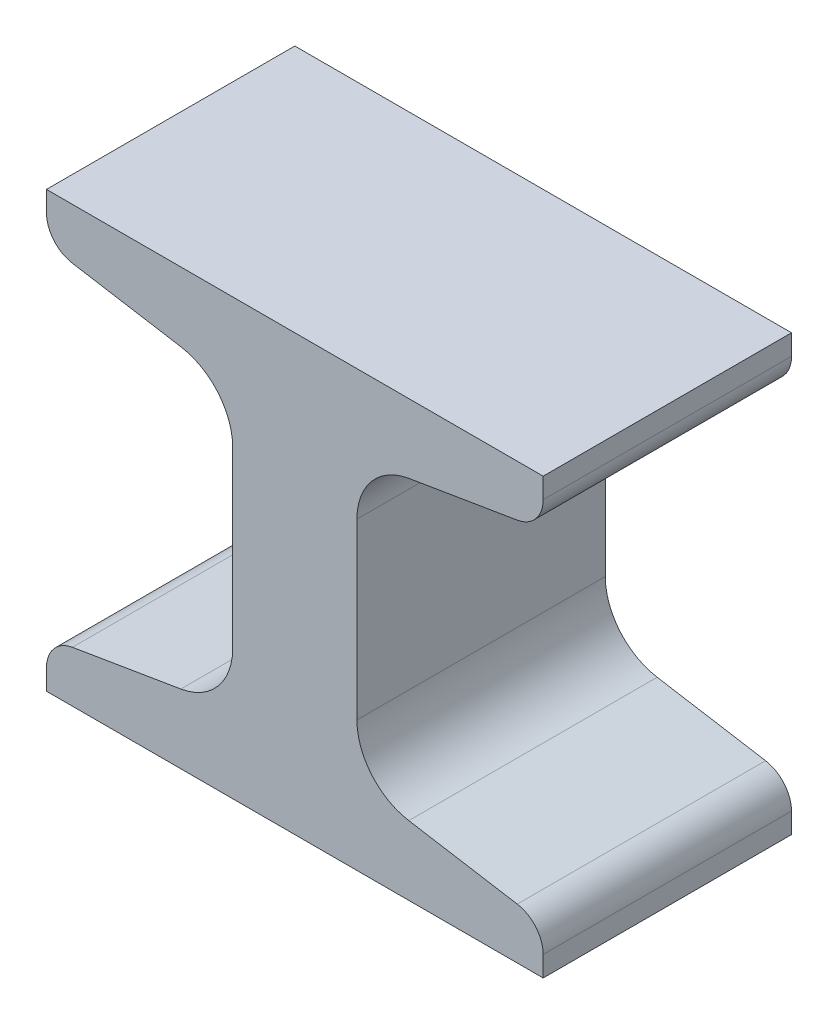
SolidWorks part; units mm, degrees
ref_plane "Plane1" through (0, 0, 0) normal (0, 0, 1) x (1, 0, 0)
ref_plane "Plane2" through (0, 0, 0) normal (0, 1, 0) x (-1, 0, 0)
ref_plane "Plane3" through (0, 0, 0) normal (1, 0, 0) x (0, 0, -1)
sketch "Sketch1" plane through (0, 0, 0) normal (0, 0, 1) x (1, 0, 0)
  line L0 (0, 0) -> (0, 4.7767)
  line L1 (0, 4.7767) -> (13.744, 7.0676)
  line L2 (19.05, 13.3312) -> (19.05, 31.1188)
  line L3 (13.744, 37.3824) -> (0, 39.6733)
  line L4 (0, 39.6733) -> (0, 44.45)
  line L5 (0, 44.45) -> (50.8, 44.45)
  line L6 (50.8, 44.45) -> (50.8, 39.6733)
  line L7 (50.8, 39.6733) -> (37.056, 37.3824)
  line L8 (31.75, 31.1188) -> (31.75, 13.3312)
  line L9 (37.056, 7.0676) -> (50.8, 4.7767)
  line L10 (50.8, 4.7767) -> (50.8, 0)
  line L11 (50.8, 0) -> (0, 0)
  line L12 (15.6984, 0) -> (-15.6984, 0) construction
  line L13 (0, -13.7361) -> (0, 13.7361) construction
  line L14 (50.8, 6.3644) -> (31.75, 6.3644) construction
  arc A0 (13.744, 7.0676) -> (19.05, 13.3312) centre (12.7, 13.3312) ccw
  arc A1 (19.05, 31.1188) -> (13.744, 37.3824) centre (12.7, 31.1188) ccw
  arc A2 (37.056, 37.3824) -> (31.75, 31.1188) centre (38.1, 31.1188) ccw
  arc A3 (31.75, 13.3312) -> (37.056, 7.0676) centre (38.1, 13.3312) ccw
  dimension "D7" = 9.463
  dimension "RI" = 6.35
  dimension "BF" = 50.8
  dimension "D6" = 9.463
  dimension "DEPTH" = 44.45
  dimension "TW" = 12.7
  dimension "D1" = 17.7877
  dimension "TF" = 6.3644
extrude "BaseSbeam" add sketch "Sketch1" along normal mid plane 25.4
fillet "ToeFillet" radius 3.175 4 edges at (50.8, 4.7767, 0) (0, 4.7767, 0) (50.8, 39.6733, 0) (0, 39.6733, 0)
equation "\"d1@Sketch1\" = \"Depth@Sketch1\" - 2*\"TF@Sketch1\" -  2*( \"RI@Sketch1\" * cos(\"D6@Sketch1\"/180*3.141592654))-2*((((\"BF@Sketch1\"-\"TW@Sketch1\")/4)-(\"RI@Sketch1\"-\"RI@Sketch1\"*sin(\"D6@Sketch1\"/180*3.141592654"
